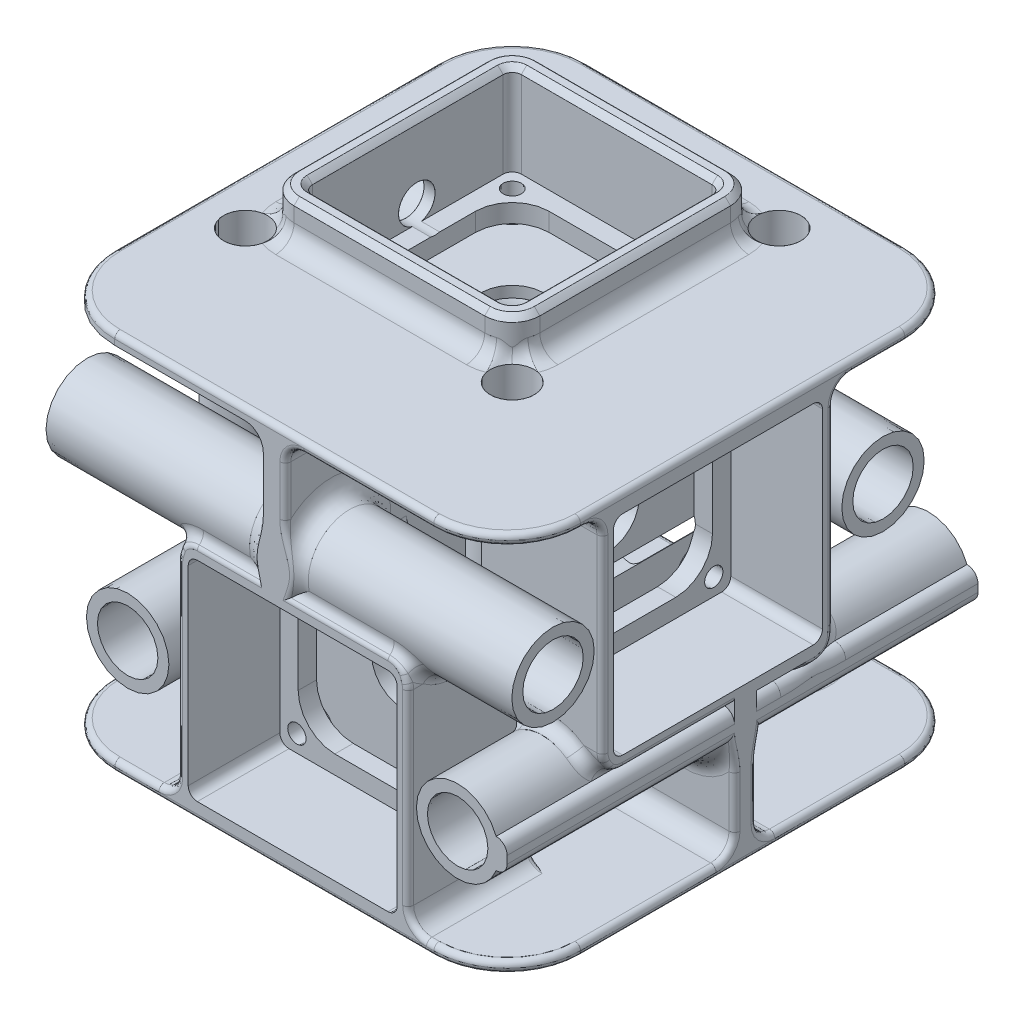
SolidWorks part; units mm, degrees
ref_plane "Front Plane" through (0, 0, 0) normal (0, 0, 1) x (1, 0, 0)
ref_plane "Top Plane" through (0, 0, 0) normal (0, 1, 0) x (1, 0, 0)
ref_plane "Right Plane" through (0, 0, 0) normal (1, 0, 0) x (0, 0, -1)
imported_body "v5.2 center hold-1-solid1"
imported_body "Stepper Motor & Rod-1/Stepper Motor No- 20190329-1-solid1"
imported_body "Stepper Motor & Rod-1/Stepper Motor No- 20190329-1-solid2"
imported_body "Stepper Motor & Rod-1/Rod-1-solid1"
imported_body "Stepper Motor & Rod-2/Stepper Motor No- 20190329-1-solid1"
imported_body "Stepper Motor & Rod-2/Stepper Motor No- 20190329-1-solid2"
imported_body "Stepper Motor & Rod-2/Rod-1-solid1"
imported_body "Stepper Motor & Rod-4/Stepper Motor No- 20190329-1-solid1"
imported_body "Stepper Motor & Rod-4/Stepper Motor No- 20190329-1-solid2"
imported_body "Stepper Motor & Rod-4/Rod-1-solid1"
delete or keep bodies "Body-Delete/Keep 1" type delete bodies bodies 108 110 105 107 106 109 103 104 102
sketch "Sketch1" plane through (0, -46.6548, 0) normal (0, -1, 0) x (1, 0, 0)
  circle A0 centre (-87.2202, -18.4458) radius 5
  circle A1 centre (-87.2202, 29.2542) radius 5
  circle A2 centre (-39.5202, 29.2542) radius 5
  circle A3 centre (-39.5202, -18.4458) radius 5
  dimension "D1" = 10
extrude "Cut-Extrude1" cut sketch "Sketch1" against normal offset from surface (84.5 mm away) 5
sketch "Sketch2" plane through (-112.8952, 0, 0) normal (-1, 0, 0) x (0, 0, 1)
  circle A0 centre (50.6421, 47.6897) radius 2.5 construction
  arc A1 (51.2921, -2.4243) -> (51.2921, 2.4037) centre (50.6421, -0.0103) ccw construction
  circle A2 centre (2.9421, -0.0103) radius 2.5 construction
  circle A3 centre (2.9421, 47.6897) radius 2.5 construction
  circle A4 centre (50.6421, 47.6897) radius 2.5 construction
  arc A5 (51.2921, -2.4243) -> (51.2921, 2.4037) centre (50.6421, -0.0103) ccw construction
  circle A6 centre (2.9421, -0.0103) radius 2.5 construction
  circle A7 centre (2.9421, 47.6897) radius 2.5 construction
  circle A8 centre (2.9421, 47.6897) radius 5
  circle A9 centre (50.6421, 47.6897) radius 5
  circle A10 centre (50.6421, -0.0103) radius 5
  circle A11 centre (2.9421, -0.0103) radius 5
  dimension "D1" = 10
extrude "Cut-Extrude2" cut sketch "Sketch2" against normal offset from surface (97.025 mm away) 5
sketch "Sketch3" plane through (0, 0, -44.1208) normal (0, 0, -1) x (-1, 0, 0)
  circle A0 centre (20.5202, 10.1952) radius 5
  circle A1 centre (20.5202, -37.5048) radius 5
  circle A2 centre (68.2202, -37.5048) radius 5
  circle A3 centre (68.2202, 10.1952) radius 5
  dimension "D1" = 10
extrude "Cut-Extrude3" cut sketch "Sketch3" against normal offset from surface (98.4129 mm away) 5
sketch "Sketch4" plane through (-52.3827, 0, 0) normal (-1, 0, 0) x (0, 0, 1)
  line L0 (16.2836, -10.8176) -> (16.2836, 34.8452) construction
  line L1 (-44.1208, -43.6548) -> (16.2836, -43.6548)
  line L2 (-44.1208, -43.6548) -> (-44.1208, 12.5897)
  line L3 (-44.1208, 12.5897) -> (16.2836, 12.5897)
  line L4 (16.2836, -43.6548) -> (16.2836, 12.5897)
  circle A0 centre (-18.2079, 23.8397) radius 11.25 construction
  circle A1 centre (-18.2079, 23.8397) radius 11.25
extrude "Cut-Extrude4" cut sketch "Sketch4" against normal blind 6 contours L4 L3 L2 M3 | M5 M2 M3 M4
fillet "Fillet1" radius 25 1 edges at (-49.3827, 12.5897, -44.1208)
fillet "Fillet2" radius 5 1 edges at (-49.3827, -43.6548, 16.2836)
fillet "Fillet3" radius 5 2 edges at (-82.6389, -43.6548, 22.2836) (-16.1264, -43.6548, 22.2836)
fillet "Fillet4" radius 5 15 edges at (-31.8702, 54.3397, 26.8439) (-33.4811, 54.3397, 35.2933) (-70.8764, 54.3397, 36.9042) (-93.2593, 54.3397, 35.2933) (-70.8764, 54.3397, -26.0958) (-93.2593, 54.3397, -24.4849) (-41.8764, 54.3397, 36.9042) (-46.3827, 54.3397, 60.5982) (-94.8702, 54.3397, 26.8439) (-103.8827, 54.3397, 22.2836) (-52.3827, 44.5924, -26.0958) (-52.3827, 54.3397, -35.1083) (-94.8702, 54.3397, -2.1561) (-94.8702, 44.5924, 16.2836) (-103.8827, 54.3397, 16.2836)
fillet "Fillet5" radius 5 2 edges at (-25.4096, -36.4592, -39.83) (-26.9952, -43.6548, -39.9708)
fillet "Fillet6" radius 5 1 edges at (-99.7452, -43.6548, -39.9708)
fillet "Fillet7" radius 5 2 edges at (-26.9952, 54.3397, -39.9708) (-100.6202, -13.6548, 16.2836)
fillet "Fillet8" radius 5 13 edges at (-44.9182, 52.8752, 38.3687) (-52.3827, 42.0924, 36.9042) (-52.3827, 52.8752, 38.3687) (-52.3827, -42.1904, 23.7481) (-99.7452, -43.6548, 32.7792) (-100.6202, -13.6548, 22.2836) (-4.4108, -23.7124, 22.2836) (-4.4108, -23.7124, 16.2836) (-46.3827, 42.0924, 36.9042) (-52.3827, 54.3397, 63.0982) (-52.3827, 34.8452, 29.5939) (-52.3827, -43.6548, 39.2879) (-52.3827, 2.9082, 22.2836)
fillet "Fillet9" radius 5 6 edges at (-46.3827, 22.6669, -7.0192) (-52.3827, 22.6669, -7.0192) (-46.3827, 22.6669, -29.3966) (-52.3827, 22.6669, -29.3966) (-46.3827, 35.0897, 71.7921) (-52.3827, 35.0897, 71.7921)
fillet "Fillet10" radius 5 4 edges at (-16.6722, -7.6603, 16.2836) (-9.8947, -7.6603, 14.0901) (-8.8901, -7.6603, 6.0379) (2.0874, -2.4997, -4.6974)
fillet "Fillet11" radius 3 5 edges at (-16.6722, -7.6603, 22.2836) (-10.7779, -7.6603, 23.5838) (-8.8901, -7.6603, 40.0379) (10.1497, -7.6603, 37.5379) (-0.8278, -2.4997, 58.2817)
fillet "Fillet12" radius 3 4 edges at (14.1298, -9.6159, -13.9186) (14.1298, -17.6937, -14.1636) (14.1298, -9.6159, 53.2879) (14.1298, -17.6937, 53.5329)
fillet "Fillet13" radius 3 5 edges at (-63.8764, 17.8452, 81.312) (-52.3827, 17.8452, 53.9902) (-54.5762, 17.8452, 61.2677) (-63.8764, 17.8452, 62.2722) (-75.8597, 12.6845, 73.2497)
fillet "Fillet14" radius 3 1 edges at (-91.3541, -24.7285, -34.2249)
fillet "Fillet15" radius 3 1 edges at (-21.3419, 14.1761, -23.9679)
fillet "Fillet16" radius 3 5 edges at (-46.3827, 17.8452, 53.9902) (-45.0825, 17.8452, 60.3845) (-29.8764, 17.8452, 62.2722) (-29.8764, 17.8452, 81.312) (-12.8807, 12.6845, 70.3345)
fillet "Fillet17" radius 3 7 edges at (-70.1571, 34.8452, -15.8752) (-56.4769, 34.8452, -15.5042) (-54.3006, 33.7823, 22.2836) (-96.3347, 52.8752, 23.7481) (-52.3827, 34.8452, 5.0158) (-76.1264, 34.8452, 22.2836) (-94.8702, 42.0924, 22.2836)
fillet "Fillet18" radius 3 12 edges at (-31.8702, 34.8452, 26.8439) (-33.4811, 34.8452, 35.2933) (-39.3764, 34.8452, 36.9042) (-53.8472, 33.3807, 38.3687) (-73.3764, 34.8452, 36.9042) (-95.7489, 33.9665, 23.1623) (-94.8702, 34.8452, 28.3439) (-96.3347, 34.8452, 14.8191) (-94.8702, 33.2494, -9.0702) (-44.9182, 34.8452, 38.3687) (-93.2593, 34.8452, 35.2933) (-94.8702, 34.8452, 2.4322)
fillet "Fillet19" radius 1 1 edges at (-31.8702, 34.8452, 0.2042)
fillet "Fillet20" radius 5 2 edges at (-46.3827, 46.1933, -26.0958) (-46.3827, 54.3397, -35.1083)
fillet "Fillet21" radius 5 8 edges at (-32.0669, 57.3397, -25.8991) (-29.8702, 57.3397, 5.4042) (-32.0669, 57.3397, 36.7075) (-63.3702, 57.3397, 38.9042) (-94.6735, 57.3397, 36.7075) (-96.8702, 57.3397, 5.4042) (-94.6735, 57.3397, -25.8991) (-63.3702, 57.3397, -28.0958)
fillet "Fillet22" radius 5 2 edges at (-2.3702, 54.3397, 55.9544) (-2.3702, 54.3397, -2.3701)
fillet "Fillet23" radius 5 2 edges at (-14.5953, -43.6548, 67.7921) (-74.1451, -43.6548, 67.7921)
fillet "Fillet25" radius 1.5 83 edges at (-44.7579, 25.0773, 84.2921) (-46.3827, 41.7813, 84.2921) (-44.9182, 52.8752, 84.2921) (-23.6264, 54.3397, 84.2921) (8.2719, 54.3397, 78.4343) (14.1298, 54.3397, 63.7921) (14.1298, 52.8752, 59.7566) (14.1298, -7.6603, 37.5379) (14.1298, -7.4887, 54.1554) (14.1298, -4.9641, 57.5238) (14.1298, -17.6937, 22.7737) (14.1298, -30.6773, 22.2836) (14.1298, -42.1904, 23.7481) (-32.0732, 17.8452, 84.2921) (-15.7537, 17.1829, 84.2921) (-13.0992, 13.9158, 84.2921) (-12.8702, -13.1548, 84.2921) (-11.4057, -42.1904, 84.2921) (-6.8702, -43.6548, 84.2921) (8.2719, -43.6548, 78.4343) (-61.6797, 17.8452, 84.2921) (-72.9867, 17.1829, 84.2921) (-75.6412, 13.9158, 84.2921) (-75.8702, -13.1548, 84.2921) (-77.3347, -42.1904, 84.2921) (-86.8827, -43.6548, 84.2921) (-107.0373, -43.6548, 78.4343) (-112.8952, -43.6548, 55.4376) (-112.8952, -43.6548, 41.7792) (-112.8952, -43.6548, 32.1295) (-112.8952, -11.0105, 22.2836) (14.1298, -17.6937, 15.7936) (14.1298, -30.6773, 16.2836) (14.1298, -42.1904, 14.8191) (14.1298, -43.6548, -6.4186) (8.2719, -43.6548, -38.2629) (-14.0307, -43.6548, -44.1208) (-62.3471, -43.6548, -44.1208) (-93.8081, -43.6548, -44.0999) (-107.0373, -43.6548, -38.2629) (-112.8743, -43.6548, -25.0337) (-112.8952, -43.6548, -6.4186) (-112.8952, -42.1904, 14.8191) (-112.8952, 5.3424, 16.2836) (-112.8952, 52.8752, 14.8191) (-112.8952, 54.3397, -6.4186) (-107.0373, 54.3397, -38.2629) (-75.1389, 54.3397, -44.1208) (-53.8472, 52.8752, -44.1208) (-52.3827, 12.5897, 4.9009) (-52.3827, 12.5897, -12.3448) (-52.3827, 12.5897, -18.6643) (-52.3827, 13.6269, -26.247) (-52.3827, 25.6844, -41.1041) (-46.3827, 12.5897, 4.9009) (-46.3827, 12.5897, -12.3448) (-46.3827, 12.5897, -18.6643) (-46.3827, 13.6269, -26.247) (-46.3827, 25.6844, -41.1041) (-46.3827, 43.4647, -44.1208) (-44.9182, 52.8752, -44.1208) (-36.5909, 54.3397, -44.1208) (-26.9952, 54.3397, -44.1208) (14.1298, -7.9108, -1.6668) (14.1298, -2.8063, -4.6698) (14.1298, 23.5897, -4.7079) (14.1298, 52.8752, -6.1723) (14.1298, 54.3397, -16.9143) (8.2719, 54.3397, -38.2629) (14.1298, 57.3397, 20.0857) (8.2719, 57.3397, 78.4343) (-49.3827, 57.3397, 84.2921) (-107.0373, 57.3397, 78.4343) (-112.8952, 57.3397, 20.0857) (-107.0373, 57.3397, -38.2629) (-49.3827, 57.3397, -44.1208) (14.1298, 23.5897, 58.2921) (14.1298, -43.6548, 45.7879) (-112.8952, -42.1904, 23.7481) (-52.3827, 43.4647, -44.1208) (-14.0307, 54.3397, -44.1208) (8.2719, 57.3397, -38.2629)
fillet "Fillet26" radius 1.5 11 edges at (-11.4057, -42.1904, 51.2921) (-46.3827, 24.4674, 16.2836) (-46.822, 13.029, 16.2836) (-49.3827, 12.5897, 16.2836) (-51.9433, 13.029, 16.2836) (-95.5088, 35.1738, 16.2836) (-74.5039, 34.8452, 16.2836) (-53.2614, 33.9665, 16.2836) (-12.8702, -23.1732, 51.2921) (-18.8702, -3.5925, 16.2836) (-52.3827, 22.9674, 16.2836)
fillet "Fillet27" radius 1.5 8 edges at (14.1298, -46.6548, 20.0857) (8.2719, -46.6548, -38.2629) (-49.3827, -46.6548, -44.1208) (-107.0373, -46.6548, -38.2629) (-112.8952, -46.6548, 20.0857) (-107.0373, -46.6548, 78.4343) (-49.3827, -46.6548, 84.2921) (8.2719, -46.6548, 78.4343)
fillet "Fillet28" radius 1.5 16 edges at (-35.6024, 67.8452, -22.3635) (-63.3702, 67.8452, -23.0958) (-91.138, 67.8452, -22.3635) (-91.8702, 67.8452, 5.4042) (-91.138, 67.8452, 33.172) (-63.3702, 67.8452, 33.9042) (-35.6024, 67.8452, 33.172) (-34.8702, 67.8452, 5.4042) (-63.3702, 67.8452, 38.9042) (-94.6735, 67.8452, 36.7075) (-96.8702, 67.8452, 5.4042) (-94.6735, 67.8452, -25.8991) (-63.3702, 67.8452, -28.0958) (-32.0669, 67.8452, -25.8991) (-29.8702, 67.8452, 5.4042) (-32.0669, 67.8452, 36.7075)
